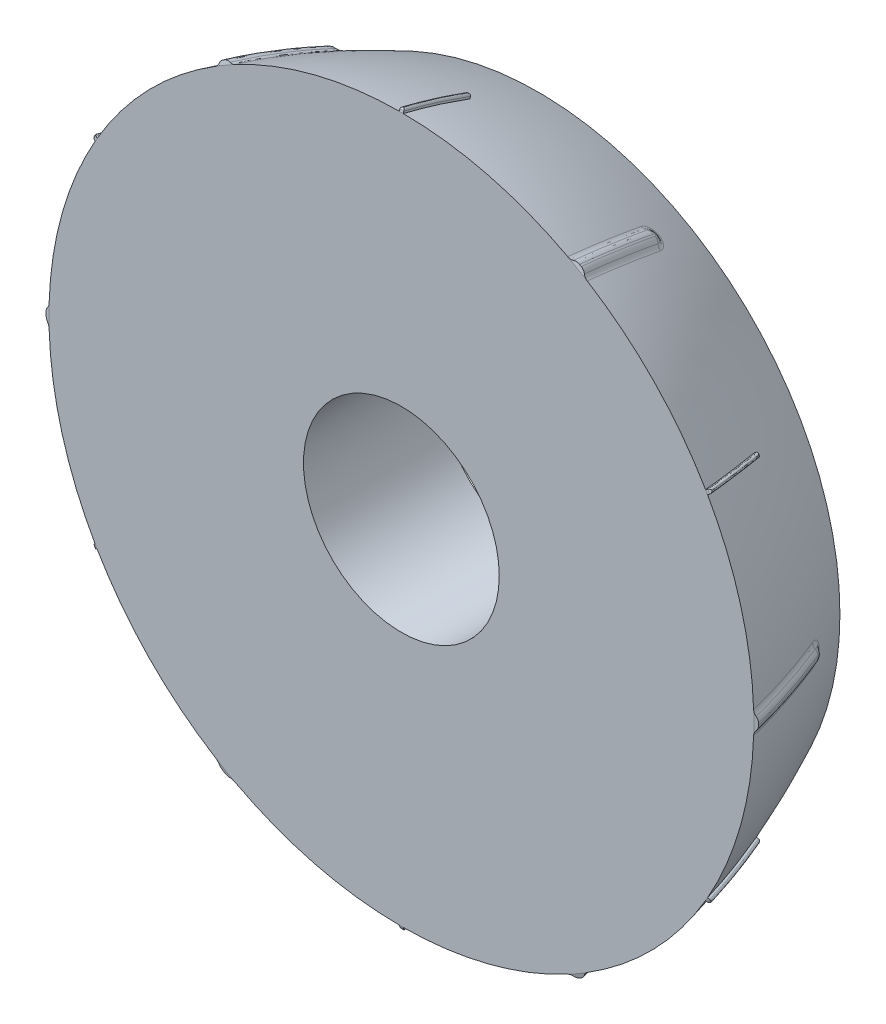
SolidWorks part; units mm, degrees
ref_plane "Front Plane" through (0, 0, 0) normal (0, 0, 1) x (1, 0, 0)
ref_plane "Top Plane" through (0, 0, 0) normal (0, 1, 0) x (1, 0, 0)
ref_plane "Right Plane" through (0, 0, 0) normal (1, 0, 0) x (0, 0, -1)
body saved out of another part "ECOSTEM-3D BLADE-HUB BASE PART"
sketch "Sketch1" plane through (0, 0, 0) normal (1, 0, 0) x (0, 0, -1)
  spline S0 degree 3 poles (-176.5177, -1962.4277) (-117.5308, 2158.2798) (342.1566, -2141.5048) (-169.6126, 2009.0597) knots -20.875434 -20.875434 -20.875434 -20.875434 25.900581 25.900581 25.900581 25.900581 only from (19.9136, 22.86) to (28.8036, 19.558)
  spline S1 degree 3 poles (-2077.0545, -18897.7122) (2031.6556, 19241.3396) (-1333.8547, -19292.3467) (306.9251, 18950.6406) knots -50.258672 -50.258672 -50.258672 -50.258672 47.382442 47.382442 47.382442 47.382442 only from (28.8036, -19.558) to (19.9136, -22.86)
  spline S3 degree 3 poles (19.9136, 22.86) (21.3754, 22.5031) (22.8152, 22.0534) (24.2316, 21.529) knots 0 0 0 0 0.477014 0.477014 0.477014 0.477014
  dimension "D1" = 4.318
extrude "Extrude-Thin1" add sketch "Sketch1" along normal mid plane 0.254 thin
fillet "Fillet1" radius 0.127 4 edges at (0, 21.7672, -24.3198) (0, 23.1068, -19.9738)
sketch "Sketch2" plane through (0, 0, -19.9136) normal (0, 0, 1) x (1, 0, 0)
  line L0 (0, 0) -> (0, 24.8351)
  line L1 (0, 0) -> (13.6626, 23.6643)
  dimension "D1" = 30
ref_plane "Plane1" through (0, 0, 0) normal (0.866, -0.5, 0) x (0, 0, -1)
sketch "Sketch3" plane through (0, 0, 0) normal (0.866, -0.5, 0) x (0, 0, -1)
  spline S0 degree 3 poles (-176.5177, 1962.4277) (-117.5308, -2158.2798) (342.1566, 2141.5048) (-169.6126, -2009.0597) knots -20.875434 -20.875434 -20.875434 -20.875434 25.900581 25.900581 25.900581 25.900581 only from (19.9136, -22.86) to (28.8036, -19.558)
  spline S1 degree 3 poles (-45.8981, -1016.7635) (222.5238, 1114.5665) (-47.672, -1128.2956) (-148.2177, 962.8922) knots -20.318745 -20.318745 -20.318745 -20.318745 17.203414 17.203414 17.203414 17.203414 only from (28.8036, -19.558) to (19.9136, -22.86)
  spline S3 degree 3 poles (19.9136, -22.86) (22.014, -22.3471) (24.069, -21.6429) (26.0742, -20.8004) knots 0 0 0 0 0.685398 0.685398 0.685398 0.685398
extrude "Extrude-Thin2" add sketch "Sketch3" along normal mid plane 1.016 thin
sketch "Sketch4" plane through (0, 0, -19.9136) normal (0, 0, 1) x (1, 0, 0)
  circle A0 centre (0, 0) radius 27.3252
extrude "Cut-Extrude1" cut sketch "Sketch4" along normal blind 2.54
fillet "Fillet2" radius 0.508 2 edges at (-10.8974, -17.8588, -26.1223) (-10.0175, -18.3668, -26.1223)
fillet "Fillet3" radius 0.508 4 edges at (-10.264, -18.4124, -26.07) (-10.8976, -18.0818, -25.9967)
fillet "Fillet4" radius 0.508 4 edges at (-10.0918, -18.2729, -25.897) (-10.6955, -17.8905, -25.9707)
pattern_circular "CirPattern4" count 6 over 360 of "Extrude-Thin1", "Fillet1", "Extrude-Thin2", "Cut-Extrude1", "Fillet2", "Fillet3", "Fillet4"
sketch "Sketch5" plane through (0, 0, -19.9136) normal (0, 0, 1) x (1, 0, 0)
  circle A0 centre (0, 0) radius 6.35
  dimension "D1" = 12.7
extrude "Cut-Extrude2" cut sketch "Sketch5" against normal through all
